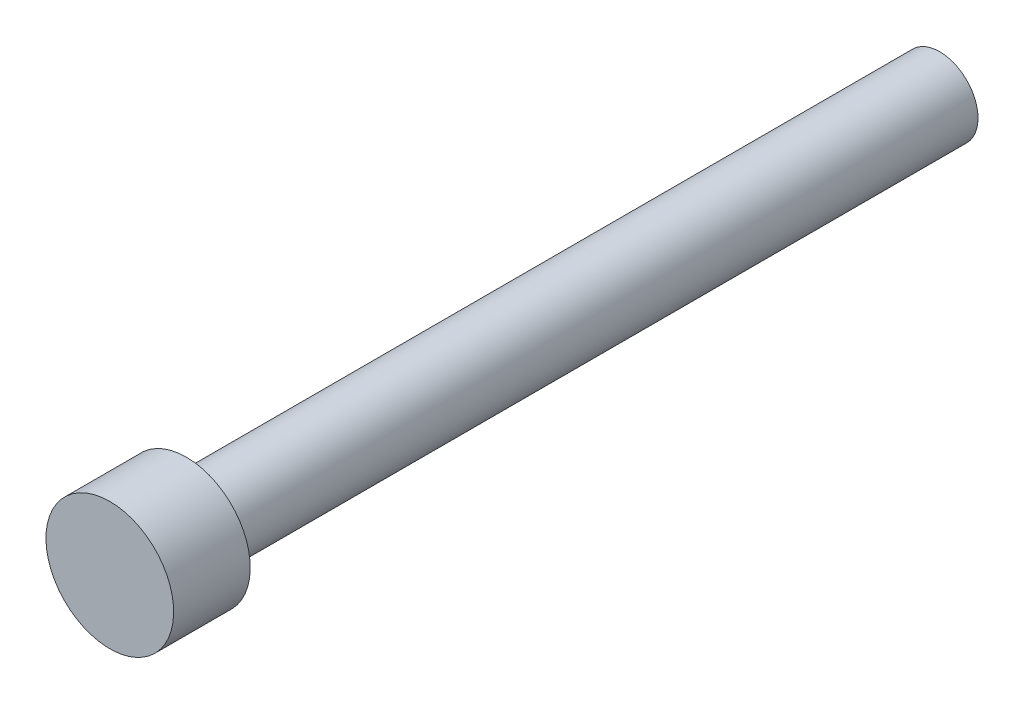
SolidWorks part; units mm, degrees
ref_plane "Plan de face" through (0, 0, 0) normal (0, 0, 1) x (1, 0, 0)
ref_plane "Plan de dessus" through (0, 0, 0) normal (0, 1, 0) x (1, 0, 0)
ref_plane "Plan de droite" through (0, 0, 0) normal (1, 0, 0) x (0, 0, -1)
sketch "Esquisse1" plane through (0, 0, 0) normal (1, 0, 0) x (0, 0, -1)
  line L0 (0, 0) -> (6, 0)
  line L1 (6, 0) -> (6, -2)
  line L2 (6, -2) -> (65, -2)
  line L3 (65, -2) -> (65, -5)
  line L4 (65, -5) -> (0, -5)
  line L5 (0, -5) -> (0, 0)
  dimension "D1" = 3
  dimension "D2" = 5
  dimension "D3" = 6
  dimension "D4" = 65
revolve "Révolution1" add sketch "Esquisse1" angle 360 about L4
